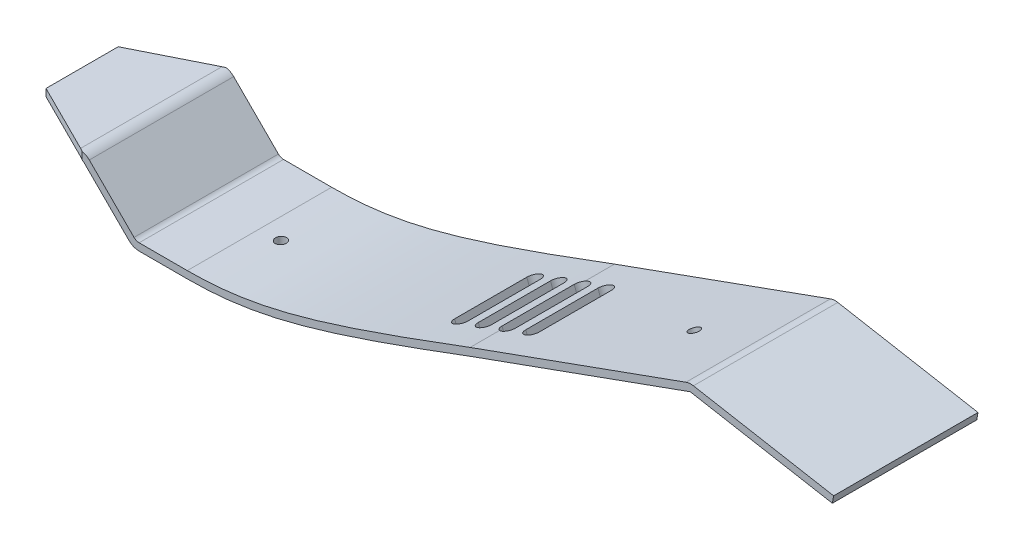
SolidWorks part; units mm, degrees
ref_plane "Plan de face" through (0, 0, 0) normal (0, 0, 1) x (1, 0, 0)
ref_plane "Plan de dessus" through (0, 0, 0) normal (0, 1, 0) x (1, 0, 0)
ref_plane "Plan de droite" through (0, 0, 0) normal (1, 0, 0) x (0, 0, -1)
sketch "Esquisse1" plane through (0, 0, 0) normal (0, 0, 1) x (1, 0, 0)
  line L0 (-94.4812, -10.1412) -> (-127.3648, 22.7423) construction
  line L1 (-128.6234, 4.0009) -> (-108.6234, 4.0009) construction
  line L2 (70.4842, 36.2844) -> (-21.1775, 3.2469) construction
  line L3 (59.8648, 32.4569) -> (108.9737, 23.639) construction
  line L4 (99.2352, 25.3876) -> (104.2913, 53.5461) construction
  line L5 (-94.4812, -10.1412) -> (-13.984, -10.1412) construction
  line L6 (-79.4812, 18.5538) -> (-79.4812, -44.9494) construction
  line L7 (99.2352, 25.3876) -> (59.8648, 32.4569)
  line L8 (59.8648, 32.4569) -> (-0.4287, 10.7254)
  line L9 (-128.6234, 4.0009) -> (-109.4518, 4.0009)
  line L10 (-108.0376, 3.4151) -> (-95.6528, -8.9697)
  line L11 (-92.8244, -10.1412) -> (-79.4812, -10.1412)
  line L12 (-128.6234, 6.0009) -> (-109.4518, 6.0009)
  line L13 (-106.6234, 4.8293) -> (-94.2386, -7.5555)
  line L14 (-92.8244, -8.1412) -> (-79.4807, -8.1412)
  line L15 (58.6825, 34.1567) -> (-1.118, 12.6029)
  line L16 (99.5886, 27.3561) -> (60.7457, 34.3307)
  line L17 (-128.6234, 4.0009) -> (-128.6234, 6.0009)
  line L18 (99.5886, 27.3561) -> (99.2352, 25.3876)
  arc A0 (-94.2386, -7.5555) -> (-92.8244, -8.1412) centre (-92.8244, -6.1412) ccw
  arc A1 (-95.6528, -8.9697) -> (-92.8244, -10.1412) centre (-92.8244, -6.1412) ccw
  arc A2 (-109.4518, 6.0009) -> (-106.6234, 4.8293) centre (-109.4518, 2.0009) cw
  arc A3 (58.6825, 34.1567) -> (60.7457, 34.3307) centre (60.0388, 30.3936) cw
  arc A4 (-109.4518, 4.0009) -> (-108.0376, 3.4151) centre (-109.4518, 2.0009) cw
  spline S0 degree 3 poles (-79.4812, -10.1412) (-59.2202, -10.1526) (-40.9191, -4.4151) (-0.4287, 10.7254) knots 0 0 0 0 1 1 1 1
  spline S1 degree 3 poles (-79.4807, -8.1412) (-74.4964, -8.144) (-67.2576, -7.6213) (-56.7782, -5.6922) (-48.2283, -3.5788) (-40.288, -1.2226) (-33.3077, 1.0418) (-27.7237, 2.9353) (-21.7561, 5.0292) (-16.4348, 6.9455) (-11.9509, 8.5841) (-8.4712, 9.8661) (-5.4674, 10.9805) (-3.0066, 11.8972) (-1.7449, 12.3685) (-1.118, 12.6029) knots -0.000009 -0.000009 -0.000009 -0.000009 0.250016 0.375029 0.500041 0.625054 0.68756 0.750066 0.812573 0.875079 0.906332 0.937585 0.968839 0.984465 1.000092 1.000092 1.000092 1.000092
extrude "Extrusion1" add sketch "Esquisse1" along normal blind 40
sketch "Esquisse2" plane through (0, 6.0009, 0) normal (0, 1, 0) x (-1, 0, 0)
  line L0 (111.1363, 0) -> (132.5775, 0) construction
  line L1 (109.4518, 0) -> (128.6234, 0) construction
  line L2 (110.3494, 20) -> (135.0036, 20) construction
  line L3 (118.4067, 10) -> (137.2322, 10) construction
  line L4 (128.6234, 14.1623) -> (128.6234, -12.6774) construction
  line L5 (128.6234, 40) -> (128.6234, 0) construction
  line L6 (108.6234, -14.0382) -> (108.6234, 6.1482) construction
  line L7 (128.6234, 10) -> (108.6234, 0)
  line L8 (108.6234, 0) -> (108.6234, -4.7389)
  line L9 (108.6234, -4.7389) -> (133.1495, -4.7389)
  line L10 (133.1495, -4.7389) -> (133.1495, 10)
  line L11 (133.1495, 10) -> (128.6234, 10)
  line L12 (133.1495, 44.7389) -> (133.1495, 30)
  line L13 (108.6234, 44.7389) -> (133.1495, 44.7389)
  line L14 (108.6234, 40) -> (108.6234, 44.7389)
  line L15 (128.6234, 30) -> (108.6234, 40)
  line L16 (133.1495, 30) -> (128.6234, 30)
  dimension "D1" = 20
  dimension "D2" = 10
  dimension "D3" = 20
extrude "Enlèv. mat.-Extru.1" cut sketch "Esquisse2" against normal through all
sketch "Esquisse3" plane through (0, -8.1412, 0) normal (0, 1, 0) x (-1, 0, 0)
  line L0 (93.543, 20) -> (93.543, 64.0962) construction
  line L1 (73.543, -5.1074) -> (73.543, 51.8513) construction
  line L2 (58.1512, 20) -> (77.506, 20) construction
  line L3 (79.4807, 40) -> (1.118, 40) construction
  circle A0 centre (73.543, 20) radius 1.5
  dimension "D1" = 20
  dimension "D2" = 20
extrude "Enlèv. mat.-Extru.2" cut sketch "Esquisse3" against normal mid plane 40
sketch "Esquisse4" plane through (-4.1487, 11.5105, 0) normal (-0.3391, 0.9408, 0) x (-0.9408, -0.3391, 0)
  line L0 (-67.9841, 36.8311) -> (-67.9841, -7.1374) construction
  line L1 (-47.9841, 47.2589) -> (-47.9841, -18.7477) construction
  line L2 (-57.8789, 20) -> (-27.6707, 20) construction
  line L3 (-66.7878, 40) -> (-3.2215, 40) construction
  circle A0 centre (-47.9841, 20) radius 1.5
  dimension "D1" = 20
  dimension "D2" = 20
extrude "Enlèv. mat.-Extru.3" cut sketch "Esquisse4" against normal blind 40
sketch "Esquisse5" plane through (-4.1487, 11.5105, 0) normal (-0.3391, 0.9408, 0) x (-0.9408, -0.3391, 0)
  line L0 (-47.9841, 19.2921) -> (-47.9841, 53.8004) construction
  line L1 (-10.9841, 54.4454) -> (-10.9841, -8.1211) construction
  line L2 (-23.6482, 30) -> (10.1367, 30) construction
  line L3 (-23.6482, 10) -> (6.4511, 10) construction
  line L4 (77.5327, 40) -> (-3.2215, 40) construction
  line L5 (-66.7878, 0) -> (-3.2215, 0) construction
  line L6 (-5.9841, 30) -> (-5.9841, 10)
  line L7 (-12.9841, 30) -> (-12.9841, 10)
  line L8 (-8.9841, 30) -> (-8.9841, 10)
  line L9 (-1.9841, 30) -> (-1.9841, 10)
  line L10 (1.0159, 30) -> (1.0159, 10)
  line L11 (5.0159, 30) -> (5.0159, 10)
  line L12 (8.0159, 30) -> (8.0159, 10)
  line L13 (12.0159, 30) -> (12.0159, 10)
  arc A0 (-12.9841, 30) -> (-8.9841, 30) centre (-10.9841, 30) cw
  arc A1 (-8.9841, 10) -> (-12.9841, 10) centre (-10.9841, 10) cw
  arc A2 (-5.9841, 30) -> (-1.9841, 30) centre (-3.9841, 30) cw
  arc A3 (-1.9841, 10) -> (-5.9841, 10) centre (-3.9841, 10) cw
  arc A4 (1.0159, 30) -> (5.0159, 30) centre (3.0159, 30) cw
  arc A5 (5.0159, 10) -> (1.0159, 10) centre (3.0159, 10) cw
  arc A6 (8.0159, 30) -> (12.0159, 30) centre (10.0159, 30) cw
  arc A7 (12.0159, 10) -> (8.0159, 10) centre (10.0159, 10) cw
  dimension "D1" = 37
  dimension "D2" = 10
  dimension "D3" = 10
extrude "Enlèv. mat.-Extru.4" cut sketch "Esquisse5" against normal mid plane 20
